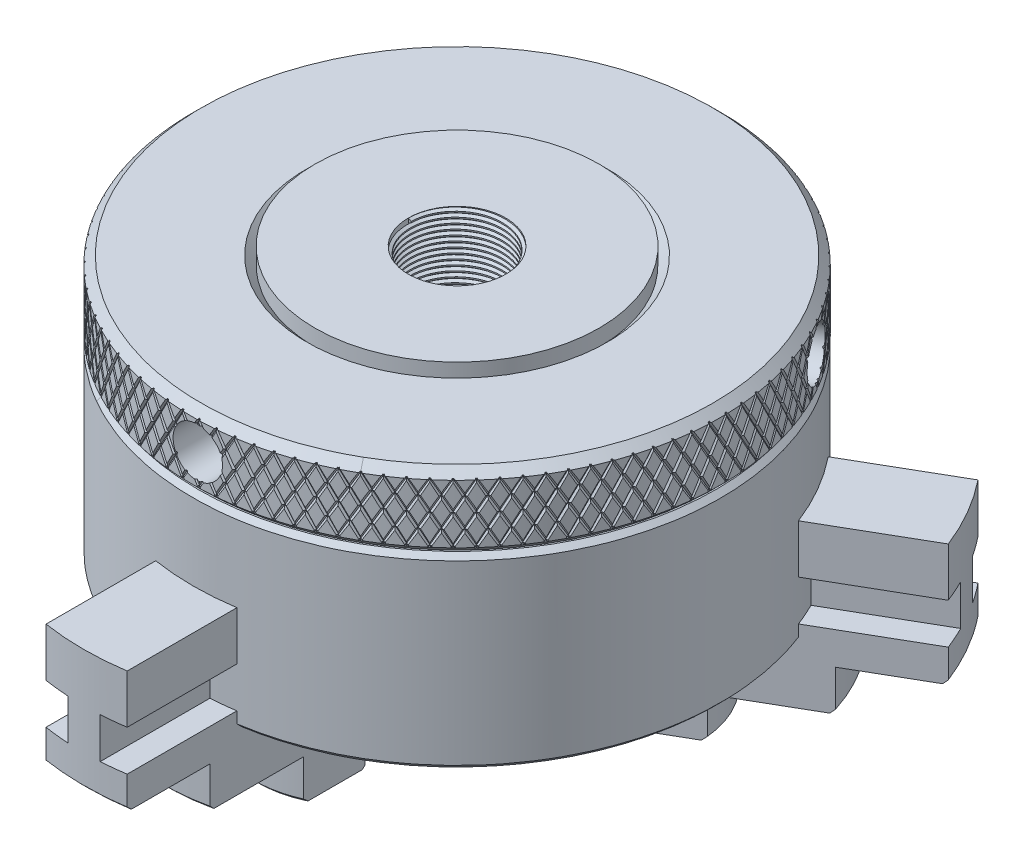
SolidWorks part; units mm, degrees
other "brep_4"
other "brep_34"
other "brep_13"
other "brep_30"
other "brep_28"
other "brep_2"
other "brep_15"
other "brep_53"
other "brep_14"
other "brep_50"
other "brep_37"
other "brep_24"
other "brep_6"
other "brep_9"
other "brep_3"
other "brep_21"
other "brep_39"
other "brep_44"
other "brep_1"
other "brep_16"
other "brep_38"
other "brep_17"
other "brep_43"
other "brep_23"
other "brep_19"
other "brep_31"
other "brep_52"
other "brep_35"
other "brep_41"
other "brep_20"
other "brep_8"
other "brep_22"
other "brep_5"
other "brep_36"
other "brep_33"
other "brep_47"
other "brep_40"
other "brep_7"
other "brep_45"
other "brep_18"
other "brep_49"
other "brep_42"
other "brep_25"
other "brep_26"
other "brep_11"
other "brep_51"
other "brep_32"
other "brep_12"
other "brep_48"
other "brep_46"
other "brep_29"
other "brep_10"
other "brep_27"
ref_plane "Спереди" through (0, 0, 0) normal (0, 0, 1) x (1, 0, 0)
ref_plane "Сверху" through (0, 0, 0) normal (0, 1, 0) x (1, 0, 0)
ref_plane "Справа" through (0, 0, 0) normal (1, 0, 0) x (0, 0, -1)
imported_body "Импортированный1"
imported_body "Импортированный2"
imported_body "Импортированный3"
imported_body "Импортированный4"
imported_body "Импортированный5"
imported_body "Импортированный6"
imported_body "Импортированный7"
imported_body "Импортированный8"
imported_body "Импортированный9"
imported_body "Импортированный10"
imported_body "Импортированный11"
imported_body "Импортированный12"
imported_body "Импортированный13"
imported_body "Импортированный14"
imported_body "Импортированный15"
imported_body "Импортированный16"
imported_body "Импортированный17"
imported_body "Импортированный18"
imported_body "Импортированный19"
imported_body "Импортированный20"
imported_body "Импортированный21"
imported_body "Импортированный22"
imported_body "Импортированный23"
imported_body "Импортированный24"
imported_body "Импортированный25"
imported_body "Импортированный26"
imported_body "Импортированный27"
imported_body "Импортированный28"
imported_body "Импортированный29"
imported_body "Импортированный30"
imported_body "Импортированный31"
imported_body "Импортированный32"
imported_body "Импортированный33"
imported_body "Импортированный34"
imported_body "Импортированный35"
imported_body "Импортированный36"
imported_body "Импортированный37"
imported_body "Импортированный38"
imported_body "Импортированный39"
imported_body "Импортированный40"
imported_body "Импортированный41"
imported_body "Импортированный42"
imported_body "Импортированный43"
imported_body "Импортированный44"
imported_body "Импортированный45"
imported_body "Импортированный46"
imported_body "Импортированный47"
imported_body "Импортированный48"
imported_body "Импортированный49"
imported_body "Импортированный50"
imported_body "Импортированный51"
imported_body "Импортированный52"
imported_body "Импортированный53"
sketch "Эскиз1" plane through (0, -9, 0) normal (0, 1, 0) x (1, 0, 0)
  circle A0 centre (0, 0) radius 17.5
  circle A1 centre (0, 0) radius 6
extrude "Бобышка-Вытянуть1" add sketch "Эскиз1" along normal blind 10
thread "Резьба1" pitch 0.635 start angle 0, offset 0, length 10, pitch 0.635, diameter 12
ref_plane "Плоскость1" through (-6, 1, 0) normal (0, 0, 1) x (-1, 0, 0)
sketch "Профиль резьбы1" plane through (-6, 1, 0) normal (0, 0, 1) x (-1, 0, 0)
  line L0 (0, 0) -> (0, 0.635) construction
  line L11 (0, 0) -> (0, 0.5556)
  line L12 (0, 0.5556) -> (-0.3437, 0.3572)
  line L13 (-0.3437, 0.3572) -> (-0.3437, 0.1984)
  line L15 (-0.3437, 0.1984) -> (0, 0)
  line L17 (-0.3437, 0.2778) -> (0, 0.2778) construction
  point P2 (0, 0)
  dimension "Pitch" = 0.635
  dimension "Profile_Angle" = 60
  dimension "Profile_Land" = 0.1588
  dimension "Profile_Height" = 0.3437
